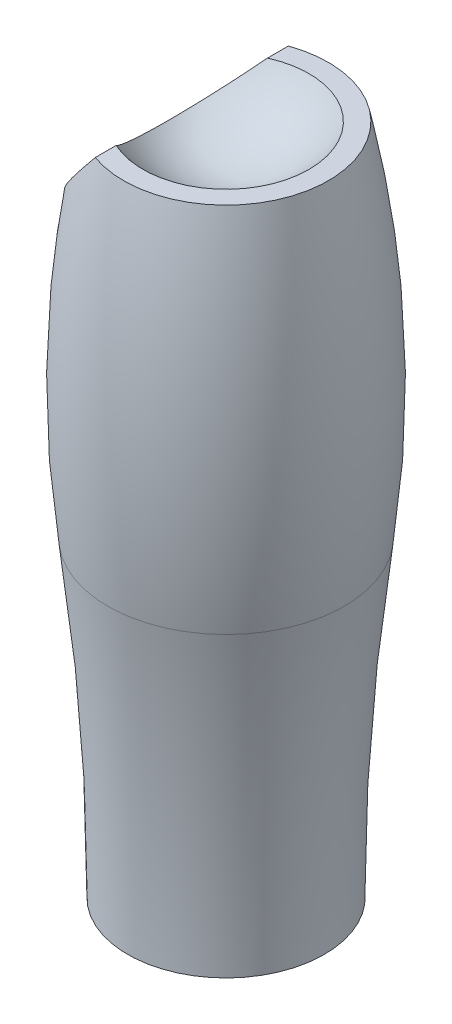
SolidWorks part; units mm, degrees
ref_plane "Přední" through (0, 0, 0) normal (0, 0, 1) x (1, 0, 0)
ref_plane "Horní" through (0, 0, 0) normal (0, 1, 0) x (1, 0, 0)
ref_plane "Pravá" through (0, 0, 0) normal (1, 0, 0) x (0, 0, -1)
sketch "Skica1" plane through (0, 0, 0) normal (0, 0, 1) x (1, 0, 0)
  line L0 (0, 0) -> (0, 235.75)
  line L1 (0, 235.75) -> (35.9375, 235.75)
  line L2 (34.5, 0) -> (0, 0)
  line L3 (0, 0) -> (0, -16.447) construction
  line L4 (34.5, 0) -> (34.5, -72.7987) construction
  arc A0 (35.9375, 235.75) -> (41.4813, 109.25) centre (-326.63, 156.4891) cw
  arc A1 (41.4813, 109.25) -> (34.5, 0) centre (892.8126, 0) ccw
  dimension "D4" = 89
  dimension "D1" = 71.875
  dimension "D2" = 235.75
  dimension "D3" = 69
  dimension "D5" = 109.25
revolve "Otočit kolem osy1" add sketch "Skica1" angle 360 about L0
sketch "Skica2" plane through (0, 0, 0) normal (0, 0, 1) x (1, 0, 0)
  line L0 (0, 219.75) -> (0, 254.25)
  line L1 (0, 254.25) -> (-34.5, 254.25)
  line L2 (0, 219.75) -> (58.1664, 219.75) construction
  line L3 (0, 254.25) -> (0, 288.1436) construction
  line L4 (-34.5, 254.25) -> (-34.5, 273.6677) construction
  line L5 (35.9375, 235.75) -> (-35.9375, 235.75) construction
  arc A0 (0, 219.75) -> (-34.5, 254.25) centre (0, 254.25) cw
  dimension "D1" = 69
  dimension "D2" = 16
revolve "Odebrat otočením1" cut sketch "Skica2" angle 360 about L0
sketch "Skica3" plane through (0, 0, 0) normal (0, 0, 1) x (1, 0, 0)
  line L0 (0, -10) -> (0, 18.75)
  line L1 (-28.75, -10) -> (0, -10)
  line L2 (-28.75, -10) -> (-28.75, -23.4225) construction
  line L3 (0, -10) -> (0, -28.9182) construction
  line L4 (-34.5, 0) -> (34.5, 0) construction
  arc A0 (0, 18.75) -> (-28.75, -10) centre (0, -10) ccw
  dimension "D1" = 57.5
  dimension "D2" = 10
revolve "Odebrat otočením2" cut sketch "Skica3" angle 360 about L0
sketch "Skica4" plane through (0, 0, 0) normal (0, 0, 1) x (1, 0, 0)
  line L0 (-41.9312, 200.0794) -> (-12, 235.75)
  line L1 (35.9375, 235.75) -> (-35.9375, 235.75) construction
  line L2 (0, -50.6) -> (0, 50.6) construction
  arc A0 (-35.9375, 235.75) -> (-41.4813, 109.25) centre (326.63, 156.4891) ccw construction
  dimension "D1" = 12
  dimension "D2" = 50
sketch "Skica5" plane through (0, 235.75, 0) normal (0, 1, 0) x (-1, 0, 0)
  line L0 (12, 0) -> (12, -33.79)
ref_plane "Rovina1" through (-123.1261, 103.3151, 0) normal (-0.766, 0.6428, 0) x (0, 0, 1)
other "Odebrat povrchem1"
